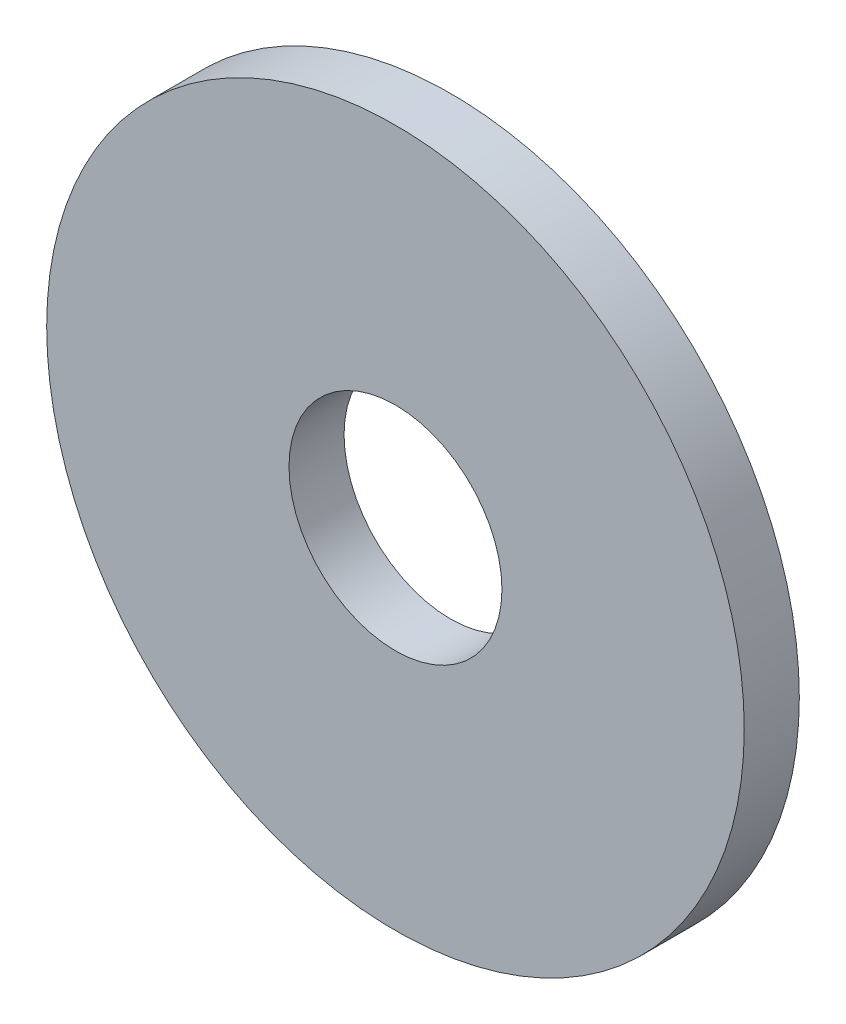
SolidWorks part; units mm, degrees
ref_plane "Front Plane" through (0, 0, 0) normal (0, 0, 1) x (1, 0, 0)
ref_plane "Top Plane" through (0, 0, 0) normal (0, 1, 0) x (1, 0, 0)
ref_plane "Right Plane" through (0, 0, 0) normal (1, 0, 0) x (0, 0, -1)
sketch "Sketch1" plane through (0, 0, 0) normal (0, 0, 1) x (1, 0, 0)
  circle A0 centre (0, 0) radius 4.826
  dimension "D1" = 9.652
extrude "Boss-Extrude1" add sketch "Sketch1" along normal blind 0.762
hole_wizard "#4 Clearance Hole1" positions "Sketch3" profile "Sketch2" hole size "#4" standard "ANSI Inch"
sketch "Sketch3" plane through (0, 0, 0.762) normal (0, 0, 1) x (1, 0, 0)
  point P0 (0, 0)
sketch "Sketch2" plane through (0, 0, 0.762) normal (1, 0, 0) x (0, -1, 0)
  line L0 (0, 0) -> (0, 0.762)
  line L1 (0, 0.762) -> (1.4732, 0.762)
  line L2 (1.4732, 0.762) -> (1.4732, 0)
  line L5 (1.4732, 0) -> (0, 0)
  line L11 (0, -6.35) -> (0, 107.95) construction
  dimension "Thru Hole Dia." = 2.9464
  dimension "Thru Hole Depth" = 0.762
